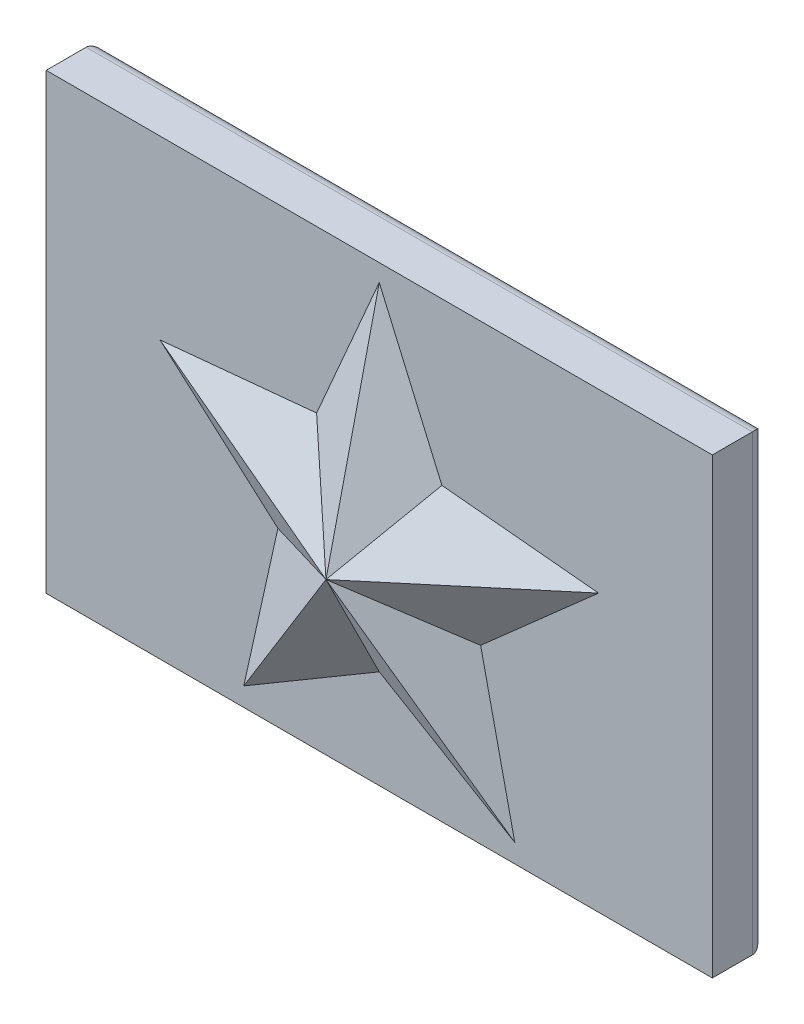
SolidWorks part; units mm, degrees
ref_plane "Front Plane" through (0, 0, 0) normal (0, 0, 1) x (1, 0, 0)
ref_plane "Top Plane" through (0, 0, 0) normal (0, 1, 0) x (1, 0, 0)
ref_plane "Right Plane" through (0, 0, 0) normal (1, 0, 0) x (0, 0, -1)
sketch "Sketch1" plane through (0, 0, 0) normal (0, 0, 1) x (1, 0, 0)
  line L1 (-15.875, -10.795) -> (15.875, -10.795)
  line L2 (-15.875, -10.795) -> (-15.875, 10.795)
  line L3 (-15.875, 10.795) -> (15.875, 10.795)
  line L4 (15.875, -10.795) -> (15.875, 10.795)
  line L5 (-15.875, -10.795) -> (15.875, 10.795) construction
  line L6 (-15.875, 10.795) -> (15.875, -10.795) construction
  point P0 (0, 0)
  dimension "D1" = 31.75
  dimension "D2" = 21.59
extrude "Boss-Extrude1" add sketch "Sketch1" along normal blind 2.54
fillet "Fillet1" radius 0.635 4 edges at (-15.875, 0, 0) (0, -10.795, 0) (0, 10.795, 0) (15.875, 0, 0)
sketch "Sketch2" plane through (0, 0, 2.54) normal (0, 0, 1) x (1, 0, 0)
  line L0 (0, -1.016) -> (0, 9.9726) construction
  line L1 (0, 9.9726) -> (-10.4508, 2.3797) construction
  line L2 (-10.4508, 2.3797) -> (-6.459, -9.906) construction
  line L3 (-6.459, -9.906) -> (6.459, -9.906) construction
  line L4 (6.459, -9.906) -> (10.4508, 2.3797) construction
  line L5 (10.4508, 2.3797) -> (0, 9.9726) construction
  line L6 (-6.459, -9.906) -> (0, -1.016) construction
  line L7 (0, -1.016) -> (6.459, -9.906) construction
  line L8 (-10.4508, 2.3797) -> (0, -1.016) construction
  line L9 (0, -1.016) -> (10.4508, 2.3797) construction
  line L10 (-10.4508, 2.3797) -> (-2.9859, 3.0938)
  line L11 (-2.9859, 3.0938) -> (0, 9.9726)
  line L12 (0, 9.9726) -> (2.9859, 3.0938)
  line L13 (2.9859, 3.0938) -> (10.4508, 2.3797)
  line L14 (10.4508, 2.3797) -> (4.8314, -2.5858)
  line L15 (4.8314, -2.5858) -> (6.459, -9.906)
  line L16 (6.459, -9.906) -> (0, -6.096)
  line L17 (0, -6.096) -> (-6.459, -9.906)
  line L18 (-6.459, -9.906) -> (-4.8314, -2.5858)
  line L19 (-4.8314, -2.5858) -> (-10.4508, 2.3797)
  line L20 (-2.9859, 3.0938) -> (0, -1.016) construction
  line L21 (0, -1.016) -> (2.9859, 3.0938) construction
  line L22 (4.8314, -2.5858) -> (0, -1.016) construction
  line L23 (0, -1.016) -> (0, -6.096) construction
  line L24 (-4.8314, -2.5858) -> (0, -1.016) construction
  line L25 (0, -1.016) -> (0, 0) construction
  circle A0 centre (0, -1.016) radius 8.89 construction
  point P1 (0, -5.6202)
  dimension "D1" = 17.78
  dimension "D2" = 1.016
  dimension "D3" = 36
  dimension "D4" = 36
  dimension "D5" = 72
  dimension "D6" = 72
  dimension "D7" = 5.08
extrude "Boss-Extrude2" add sketch "Sketch2" along normal blind 2.54
sketch "Sketch3" plane through (0, 0, 5.08) normal (0, 0, 1) x (1, 0, 0)
  line L0 (-10.4508, 2.3797) -> (4.8314, -2.5858) construction
  line L1 (10.4508, 2.3797) -> (-4.8314, -2.5858) construction
  line L2 (-6.459, -9.906) -> (2.9859, 3.0938) construction
  line L3 (6.459, -9.906) -> (-2.9859, 3.0938) construction
  line L4 (0, 9.9726) -> (0, -6.096) construction
  point P20 (0, -1.016)
  point P21 (0, -1.016)
ref_plane "Plane1" through (0.4831, -0.351, 0) normal (-0.809, 0.5878, 0) x (0, 0, 1)
sketch "Sketch4" plane through (0.4831, -0.351, 0) normal (-0.809, 0.5878, 0) x (0, 0, 1)
  line L0 (2.54, 4.258) -> (5.08, -0.822)
sketch "Sketch5" plane through (0, 0, 2.54) normal (0, 0, 1) x (1, 0, 0)
  line L0 (0, 9.9726) -> (2.9859, 3.0938)
  line L1 (2.9859, 3.0938) -> (10.4508, 2.3797)
  line L2 (10.4508, 2.3797) -> (17.6563, 12.2971)
  line L3 (17.6563, 12.2971) -> (7.2055, 19.8901)
  line L4 (7.2055, 19.8901) -> (0, 9.9726)
  line L5 (2.9859, 3.0938) -> (12.4309, 16.0936) construction
  line L6 (-6.459, -9.906) -> (2.9859, 3.0938) construction
  point P4 (9.5729, 12.2627)
  point P12 (9.9664, 12.7016)
sweep "Cut-Sweep1" cut profiles "Sketch5" path "Sketch4"
sketch "Sketch7" plane through (0.4831, -0.351, 0) normal (-0.809, 0.5878, 0) x (0, 0, 1)
  line L0 (5.08, -0.822) -> (2.54, -0.822)
  line L1 (2.54, 0.7478) -> (2.54, -4.2176) construction
pattern_circular "CirPattern1" count 5 every 72 about axis through (0, -1.016, 0) along (0, 0, 1) of "Cut-Sweep1"
